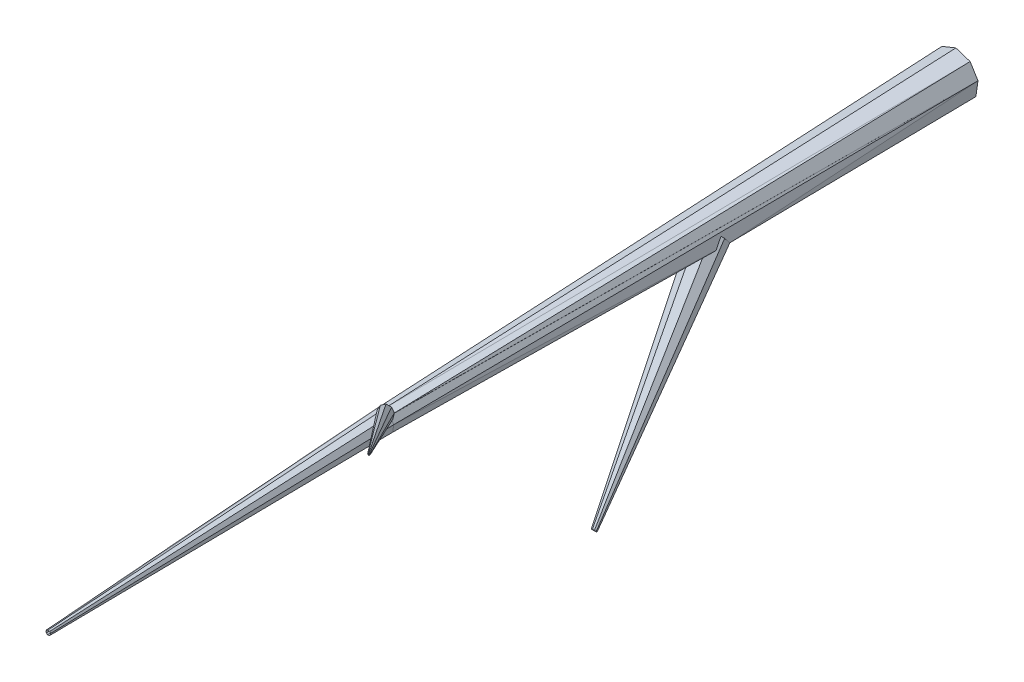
SolidWorks part; units mm, degrees
ref_plane "Front Plane" through (0, 0, 0) normal (0, 0, 1) x (1, 0, 0)
ref_plane "Top Plane" through (0, 0, 0) normal (0, 1, 0) x (1, 0, 0)
ref_plane "Right Plane" through (0, 0, 0) normal (1, 0, 0) x (0, 0, -1)
sketch3d "3DSketch1"
  point P0 (-161.8918, 166.2026, -607.1117)
sketch3d "3DSketch2"
  line L0 (-198.1465, 110.9499, -1238.6212) -> (-206.4755, 150.6165, -1238.6212)
  line L1 (-206.4755, 150.6165, -1238.6212) -> (-187.3587, 186.3565, -1238.6212)
  line L2 (-187.3587, 186.3565, -1238.6212) -> (-169.7211, 120.0364, 309.664)
  line L3 (-169.7211, 120.0364, 309.664) -> (-178.7343, 103.1856, 309.664)
  line L4 (-178.7343, 103.1856, 309.664) -> (-174.8073, 84.4836, 309.664)
  line L5 (-174.8073, 84.4836, 309.664) -> (-198.1465, 110.9499, -1238.6212)
surface "Surface-Loft1"
sketch3d "3DSketch3"
  point P0 (-140.6778, 73.3009, 309.664)
sketch3d "3DSketch4"
  line L0 (-101.6952, 98.4683, -578.5503) -> (-95.5711, 114.2782, -1238.6212)
  line L1 (-95.5711, 114.2782, -1238.6212) -> (-125.7588, 87.2318, -1238.6212)
  line L2 (-125.7588, 87.2318, -1238.6212) -> (-166.269, 85.9174, -1238.6212)
  line L3 (-166.269, 85.9174, -1238.6212) -> (-159.7777, 72.6812, 309.664)
  line L4 (-159.7777, 72.6812, 309.664) -> (-131.958, 72.6812, 1238.6212)
  line L5 (-131.958, 72.6812, 1238.6212) -> (-127.6019, 72.8226, 1238.6212)
  line L6 (-127.6019, 72.8226, 1238.6212) -> (-124.3558, 75.7309, 1238.6212)
  line L7 (-124.3558, 75.7309, 1238.6212) -> (-126.4449, 86.0528, 309.664)
  line L8 (-126.4449, 86.0528, 309.664) -> (-115.6475, 91.4692, -77.8299)
  line L9 (-115.6475, 91.4692, -77.8299) -> (-101.6952, 98.4683, -578.5503)
surface "Surface-Loft2"
sketch3d "3DSketch5"
  point P0 (-151.9851, 127.1513, 309.664)
sketch3d "3DSketch6"
  line L0 (-133.8252, 121.2011, 309.664) -> (-126.039, 83.7472, 1238.6212)
  line L1 (-126.039, 83.7472, 1238.6212) -> (-130.1807, 85.1042, 1238.6212)
  line L2 (-130.1807, 85.1042, 1238.6212) -> (-169.7211, 120.0364, 309.664)
  line L3 (-169.7211, 120.0364, 309.664) -> (-187.3587, 186.3565, -1238.6212)
  line L4 (-187.3587, 186.3565, -1238.6212) -> (-149.7411, 201.447, -1238.6212)
  line L5 (-149.7411, 201.447, -1238.6212) -> (-111.2244, 188.8268, -1238.6212)
  line L6 (-111.2244, 188.8268, -1238.6212) -> (-133.5922, 121.7874, 298.1046)
  line L7 (-133.5922, 121.7874, 298.1046) -> (-133.8252, 121.2011, 309.664)
surface "Surface-Loft3"
sketch3d "3DSketch7"
  point P0 (-154.954, 95.9711, 818.3032)
sketch3d "3DSketch8"
  line L0 (-178.7343, 103.1856, 309.664) -> (-169.7211, 120.0364, 309.664)
  line L1 (-169.7211, 120.0364, 309.664) -> (-130.1807, 85.1042, 1238.6212)
  line L2 (-130.1807, 85.1042, 1238.6212) -> (-134.2258, 83.4815, 1238.6212)
  line L3 (-134.2258, 83.4815, 1238.6212) -> (-136.2814, 79.6384, 1238.6212)
  line L4 (-136.2814, 79.6384, 1238.6212) -> (-178.7343, 103.1856, 309.664)
surface "Surface-Loft4"
sketch3d "3DSketch9"
  point P0 (-89.831, 154.4012, -1238.6212)
sketch3d "3DSketch10"
  line L0 (-95.5711, 114.2782, -1238.6212) -> (-101.6952, 98.4683, -578.5503)
  line L1 (-101.6952, 98.4683, -578.5503) -> (-123.7386, 104.9701, 309.664)
  line L2 (-123.7386, 104.9701, 309.664) -> (-133.8252, 121.2011, 309.664)
surface "Surface-Loft5"
sketch3d "3DSketch11"
  line L0 (202.7267, 396.2995, 706.2132) -> (202.0171, 397.8978, 705.8074)
  line L1 (202.0171, 397.8978, 705.8074) -> (202.3594, 399.2887, 704.8811)
  line L2 (202.3594, 399.2887, 704.8811) -> (203.5935, 399.8213, 703.8678)
  line L3 (203.5935, 399.8213, 703.8678) -> (205.1419, 399.2464, 703.2416)
  line L4 (205.1419, 399.2464, 703.2416) -> (206.2801, 397.8331, 703.2955)
  line L5 (206.2801, 397.8331, 703.2955) -> (206.4755, 396.2426, 704.0043)
  line L6 (206.4755, 396.2426, 704.0043) -> (205.6367, 395.2192, 705.0364)
  line L7 (205.6367, 395.2192, 705.0364) -> (204.1562, 395.2417, 705.9087)
  line L8 (204.1562, 395.2417, 705.9087) -> (202.7267, 396.2995, 706.2132)
sketch3d "3DSketch12"
  line L0 (-158.0727, 111.2221, 318.206) -> (-162.9614, 122.2332, 315.41)
  line L1 (-162.9614, 122.2332, 315.41) -> (-160.6029, 131.8153, 309.0284)
  line L2 (-160.6029, 131.8153, 309.0284) -> (-152.1009, 135.4846, 302.0472)
  line L3 (-152.1009, 135.4846, 302.0472) -> (-141.4336, 131.5243, 297.7331)
  line L4 (-141.4336, 131.5243, 297.7331) -> (-133.5922, 121.7874, 298.1046)
  line L5 (-133.5922, 121.7874, 298.1046) -> (-132.246, 110.83, 302.9879)
  line L6 (-132.246, 110.83, 302.9879) -> (-138.0247, 103.7791, 310.0981)
  line L7 (-138.0247, 103.7791, 310.0981) -> (-148.2245, 103.9339, 316.1082)
  line L8 (-148.2245, 103.9339, 316.1082) -> (-158.0727, 111.2221, 318.206)
surface "Surface-Loft6"
sketch3d "3DSketch13"
  line L0 (-111.2966, -395.0405, -213.2623) -> (-109.3117, -392.058, -210.8626)
  line L1 (-109.3117, -392.058, -210.8626) -> (-105.1268, -390.5546, -209.8738)
  line L2 (-105.1268, -390.5546, -209.8738) -> (-100.7001, -391.2337, -210.7583)
  line L3 (-100.7001, -391.2337, -210.7583) -> (-98.1028, -393.7775, -213.1024)
  line L4 (-98.1028, -393.7775, -213.1024) -> (-98.5503, -396.9958, -215.8092)
  line L5 (-98.5503, -396.9958, -215.8092) -> (-101.8331, -399.3826, -217.6122)
  line L6 (-101.8331, -399.3826, -217.6122) -> (-106.4153, -399.8213, -217.6677)
  line L7 (-106.4153, -399.8213, -217.6677) -> (-110.1527, -398.1064, -215.9498)
  line L8 (-110.1527, -398.1064, -215.9498) -> (-111.2966, -395.0405, -213.2623)
sketch3d "3DSketch14"
  line L0 (-181.3596, 110.6891, -562.632) -> (-168.9542, 129.3292, -547.6345)
  line L1 (-168.9542, 129.3292, -547.6345) -> (-142.7987, 138.7255, -541.4539)
  line L2 (-142.7987, 138.7255, -541.4539) -> (-115.1316, 134.4813, -546.9823)
  line L3 (-115.1316, 134.4813, -546.9823) -> (-98.8985, 118.5825, -561.6328)
  line L4 (-98.8985, 118.5825, -561.6328) -> (-101.6952, 98.4683, -578.5503)
  line L5 (-101.6952, 98.4683, -578.5503) -> (-122.213, 83.5505, -589.819)
  line L6 (-122.213, 83.5505, -589.819) -> (-150.8514, 80.8091, -590.166)
  line L7 (-150.8514, 80.8091, -590.166) -> (-174.2102, 91.527, -579.4291)
  line L8 (-174.2102, 91.527, -579.4291) -> (-181.3596, 110.6891, -562.632)
surface "Surface-Loft7"
sketch3d "3DSketch15"
  spline S0 degree 2 poles (-166.269, 85.9174, -1238.6212) (-181.0036, 68.7088, 0.499) (-131.958, 72.6812, 1238.6212) knots 0 0 0 1 1 1
sketch3d "3DSketch16"
  spline S0 degree 2 poles (-198.1465, 110.9499, -1238.6212) (-200.63, 84.1254, 0.8521) (-135.3858, 75.373, 1238.6212) knots 0 0 0 1 1 1
surface "Surface-Loft8"
sketch3d "3DSketch17"
  line L0 (-126.4449, 86.0528, 309.664) -> (-123.7386, 104.9701, 309.664)
  line L1 (-123.7386, 104.9701, 309.664) -> (-133.8252, 121.2011, 309.664)
sketch3d "3DSketch18"
  line L0 (-124.3558, 75.7309, 1238.6212) -> (-123.7386, 80.0453, 1238.6212)
  line L1 (-123.7386, 80.0453, 1238.6212) -> (-126.039, 83.7472, 1238.6212)
surface "Surface-Loft9"
ref_plane "Plane1" through (-162.1574, -34.049, 6.5474) normal (0.9779, 0.2053, -0.0395) x (-0.0386, -0.0081, -0.9992)
sketch "Sketch1" plane through (-162.1574, -34.049, 6.5474) normal (0.9779, 0.2053, -0.0395) x (-0.0386, -0.0081, -0.9992)
  line L0 (-303.3531, 137.7123) -> (-1233.0354, 105.9437)
  line L1 (-1233.0354, 105.9437) -> (-1233.0354, 101.5853)
  line L2 (-1233.0354, 101.5853) -> (-303.3531, 118.6024)
  line L3 (-303.3531, 118.6024) -> (-303.3531, 137.7123)
surface "Surface-Plane1" sketch "Sketch1"
ref_plane "Plane2" through (-128.0401, 18.3177, -3.3117) normal (-0.9896, 0.1416, -0.0256) x (-0.0253, 0.0036, 0.9997)
sketch "Sketch2" plane through (-128.0401, 18.3177, -3.3117) normal (-0.9896, 0.1416, -0.0256) x (-0.0253, 0.0036, 0.9997)
  line L0 (313.0783, 67.2784) -> (313.0783, 86.3882)
  line L1 (313.0783, 86.3882) -> (-575.4271, 83.0738)
  line L2 (-575.4271, 83.0738) -> (-74.5426, 74.1693)
  line L3 (-74.5426, 74.1693) -> (313.0783, 67.2784)
surface "Surface-Plane2" sketch "Sketch2"
ref_plane "Plane3" through (-32.7743, -20.3672, -1.3656) normal (-0.8488, -0.5275, -0.0354) x (-0.03, -0.0187, 0.9994)
sketch "Sketch3" plane through (-32.7743, -20.3672, -1.3656) normal (-0.8488, -0.5275, -0.0354) x (-0.03, -0.0187, 0.9994)
  line L0 (-1238.0302, 178.5562) -> (299.6576, 173.9537)
  line L1 (299.6576, 173.9537) -> (-1238.0302, 219.0877)
  line L2 (-1238.0302, 219.0877) -> (-1238.0302, 178.5562)
surface "Surface-Plane3" sketch "Sketch3"
